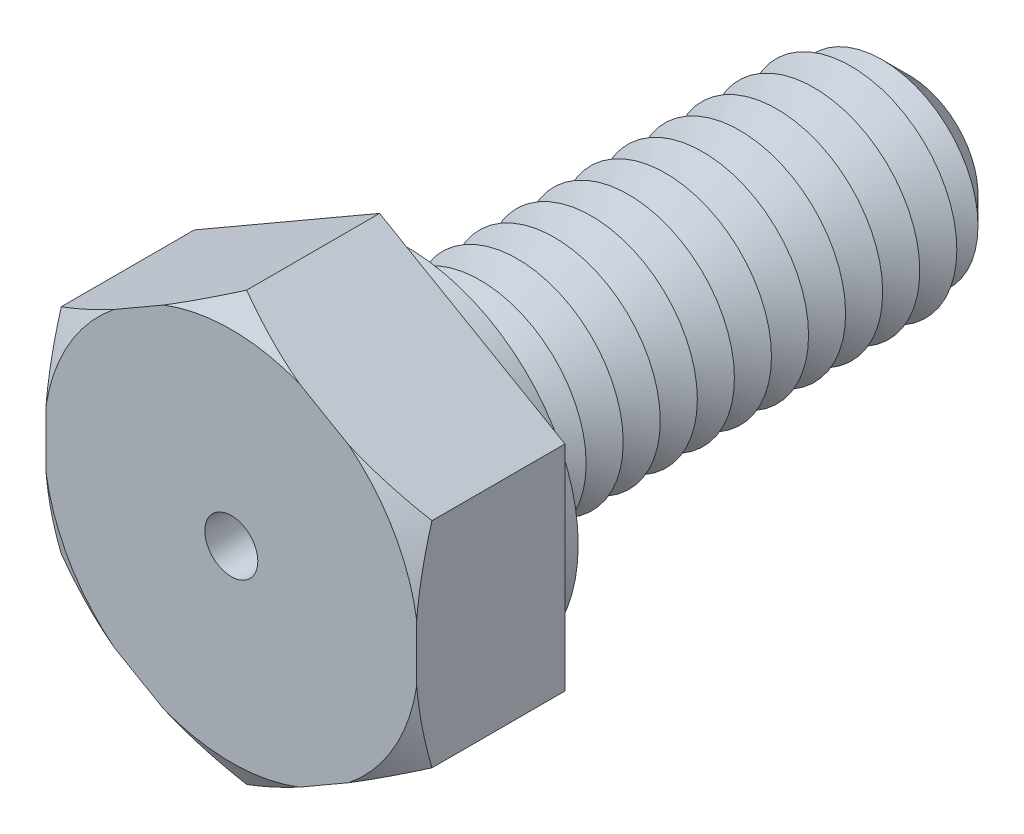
SolidWorks part; units mm, degrees
ref_plane "Front Plane" through (0, 0, 0) normal (0, 0, 1) x (1, 0, 0)
ref_plane "Top Plane" through (0, 0, 0) normal (0, 1, 0) x (1, 0, 0)
ref_plane "Right Plane" through (0, 0, 0) normal (1, 0, 0) x (0, 0, -1)
sketch "Sketch2" plane through (0, 0, 0) normal (0, 0, 1) x (1, 0, 0)
  line L1 (0, 4.0415) -> (-3.5, 2.0207)
  line L2 (-3.5, 2.0207) -> (-3.5, -2.0207)
  line L3 (-3.5, -2.0207) -> (0, -4.0415)
  line L4 (0, -4.0415) -> (3.5, -2.0207)
  line L5 (3.5, -2.0207) -> (3.5, 2.0207)
  line L6 (3.5, 2.0207) -> (0, 4.0415)
  circle A0 centre (0, 0) radius 3.5 construction
  dimension "D1" = 7
extrude "Boss-Extrude1" add sketch "Sketch2" along normal blind 2.8
sketch "Sketch3" plane through (0, 0, 0) normal (0, 0, -1) x (-1, 0, 0)
  circle A0 centre (0, 0) radius 2
  dimension "D1" = 4
extrude "Boss-Extrude2" add sketch "Sketch3" along normal blind 10
sketch "Sketch4" plane through (0, 0, 0) normal (0, 0, -1) x (-1, 0, 0)
  circle A0 centre (0, 0) radius 3.25
  dimension "D1" = 6.5
extrude "Boss-Extrude3" add sketch "Sketch4" along normal blind 0.5
sketch "Sketch5" plane through (0, 0, 0) normal (1, 0, 0) x (0, 0, -1)
  line L0 (-3.2117, 0) -> (6.3192, 0) construction
chamfer "Chamfer1" distance 0.7 angle 45 1 edges at (-2, 0, -10)
sketch "Sketch6" plane through (0, 0, 0) normal (1, 0, 0) x (0, 0, -1)
  line L0 (0.5, 2) -> (0.85, 1.3938)
  line L1 (0.85, 1.3938) -> (1.2, 2)
  line L2 (9.3, 2) -> (0.5, 2) construction
  line L3 (1.2, 2) -> (0.5, 2)
  dimension "D1" = 0.7
revolve "Cut-Revolve1" cut sketch "Sketch6" angle 360 about L0
pattern_linear "LPattern1" count 13 spacing 0.7 along (0, 0, -1) of "Cut-Revolve1"
sketch "Sketch7" plane through (0, 0, 0) normal (1, 0, 0) x (0, 0, -1)
  line L0 (-2.8, 4.0415) -> (-2.8, 3.5415)
  line L1 (-2.8, 2.0207) -> (-2.8, 4.0415) construction
  line L2 (-2.8, 3.5415) -> (-2.5113, 4.0415)
  line L3 (-2.8, 4.0415) -> (0, 4.0415) construction
  line L4 (-2.5113, 4.0415) -> (-2.8, 4.0415)
  dimension "D1" = 0.5
  dimension "D2" = 30
revolve "Cut-Revolve2" cut sketch "Sketch7" angle 360 about L0
sketch "Sketch8" plane through (0, 0, 2.8) normal (0, 0, 1) x (1, 0, 0)
  circle A0 centre (0, 0) radius 0.5
  dimension "D1" = 1
extrude "Cut-Extrude1" cut sketch "Sketch8" against normal up to surface (12.8 mm away)
